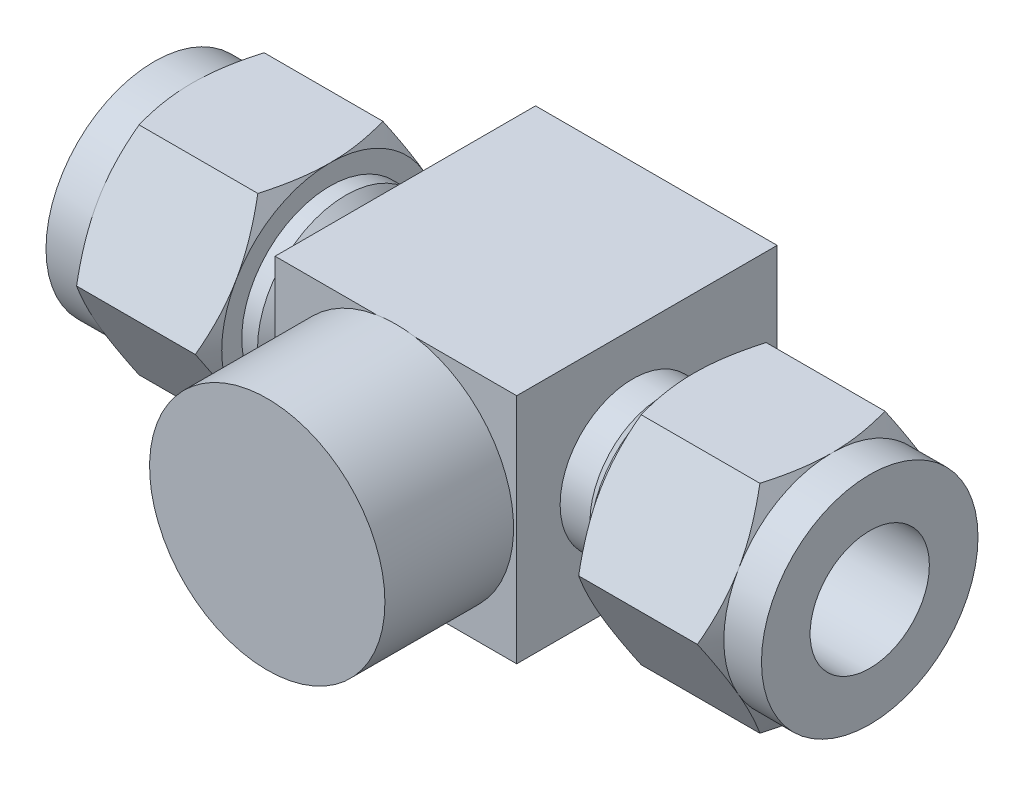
SolidWorks part; units mm, degrees
ref_plane "Front Plane" through (0, 0, 0) normal (0, 0, 1) x (1, 0, 0)
ref_plane "Top Plane" through (0, 0, 0) normal (0, 1, 0) x (1, 0, 0)
ref_plane "Right Plane" through (0, 0, 0) normal (1, 0, 0) x (0, 0, -1)
imported_body "Imported3"
sketch "Sketch1" plane through (-12.192, 0, 0) normal (-1, 0, 0) x (0, 0, 1)
  line L0 (17.5679, 0) -> (17.5679, 0.231)
  line L1 (17.5679, 0.231) -> (17.5634, 0.231)
  arc A0 (17.5634, 0.231) -> (17.5679, 0) centre (11.684, 0) cw
extrude "Cut-Extrude1" cut sketch "Sketch1" against normal blind 2.413
sketch "Sketch2" plane through (12.192, 0, 0) normal (1, 0, 0) x (0, 0, -1)
  line L0 (-17.5679, 0) -> (-17.5679, -5.8658)
  line L1 (-17.5679, -5.8658) -> (-12.1456, -5.8658)
  arc A0 (-12.1456, -5.8658) -> (-17.5679, 0) centre (-11.684, 0) cw
extrude "Cut-Extrude2" cut sketch "Sketch2" against normal blind 2.413
sketch "Sketch3" plane through (-12.192, 0, 0) normal (-1, 0, 0) x (0, 0, 1)
  line L0 (12.1456, -5.8658) -> (17.5679, -5.8658)
  line L1 (17.5679, -5.8658) -> (17.5679, 0)
  arc A0 (17.5679, 0) -> (12.1456, -5.8658) centre (11.684, 0) cw
extrude "Cut-Extrude3" cut sketch "Sketch3" against normal blind 2.413
sketch "Sketch4" plane through (12.192, 0, 0) normal (1, 0, 0) x (0, 0, -1)
  line L0 (-17.5634, 0.231) -> (-17.5679, 0.231)
  line L1 (-17.5679, 0.231) -> (-17.5679, 0)
  arc A0 (-17.5679, 0) -> (-17.5634, 0.231) centre (-11.684, 0) cw
extrude "Cut-Extrude4" cut sketch "Sketch4" against normal blind 2.413
ref_plane "Plane1" through (9.779, 0, 0) normal (1, 0, 0) x (0, 0, -1)
sketch "Sketch5" plane through (9.779, 0, 0) normal (1, 0, 0) x (0, 0, -1)
  line L0 (-17.5634, 0.231) -> (-5.8046, 0.231)
  arc A0 (-5.8046, 0.231) -> (-17.5634, 0.231) centre (-11.684, 0) ccw
extrude "Cut-Extrude5" cut sketch "Sketch5" against normal blind 19.558
sketch "Sketch6" plane through (0, 0.231, 0) normal (0, 1, 0) x (-1, 0, 0)
  line L0 (-9.779, 5.8046) -> (-9.779, 11.684)
  line L1 (-9.779, 11.684) -> (-9.779, 17.5679)
  line L2 (-9.779, 17.5679) -> (9.779, 17.5679)
  line L3 (9.779, 17.5679) -> (9.779, 11.684)
  line L4 (9.779, 11.684) -> (9.779, 5.8046)
  line L5 (9.779, 5.8046) -> (-9.779, 5.8046)
extrude "Boss-Extrude1" add sketch "Sketch6" along normal blind 5.6529
sketch "Sketch7" plane through (9.779, 0, 0) normal (1, 0, 0) x (0, 0, -1)
  line L0 (-11.2224, -5.8658) -> (-12.1456, -5.8658)
  arc A0 (-12.1456, -5.8658) -> (-11.2224, -5.8658) centre (-11.684, 0) ccw
extrude "Cut-Extrude6" cut sketch "Sketch7" against normal blind 19.558
sketch "Sketch8" plane through (9.779, 0, 0) normal (1, 0, 0) x (0, 0, -1)
  line L0 (-5.8046, 0.231) -> (-5.8046, -0.231)
  arc A0 (-5.8046, -0.231) -> (-5.8046, 0.231) centre (-11.684, 0) ccw
extrude "Cut-Extrude7" cut sketch "Sketch8" against normal blind 19.558
sketch "Sketch9" plane through (0, 0, 5.8046) normal (0, 0, -1) x (-1, 0, 0)
  line L0 (-9.779, -5.8658) -> (-9.779, 5.8839)
  line L1 (-9.779, 5.8839) -> (9.779, 5.8839)
  line L2 (9.779, 5.8839) -> (9.779, -5.8658)
  line L3 (9.779, -5.8658) -> (-9.779, -5.8658)
extrude "Boss-Extrude2" add sketch "Sketch9" along normal blind 5.8046
sketch "Sketch10" plane through (0, -5.8658, 0) normal (0, -1, 0) x (1, 0, 0)
  line L0 (-9.779, 17.5679) -> (9.779, 17.5679)
  line L1 (9.779, 17.5679) -> (9.779, 0)
  line L2 (9.779, 0) -> (-9.779, 0)
  line L3 (-9.779, 0) -> (-9.779, 17.5679)
extrude "Boss-Extrude3" add sketch "Sketch10" along normal blind 3.5322
sketch "Sketch11" plane through (0, 5.8839, 0) normal (0, 1, 0) x (-1, 0, 0)
  line L0 (-9.779, 17.5679) -> (9.779, 17.5679)
  line L1 (9.779, 17.5679) -> (9.779, 0)
  line L2 (9.779, 0) -> (-9.779, 0)
  line L3 (-9.779, 0) -> (-9.779, 17.5679)
extrude "Boss-Extrude4" add sketch "Sketch11" along normal blind 3.5141
sketch "Sketch12" plane through (0, 0, 17.5679) normal (0, 0, 1) x (1, 0, 0)
  line L0 (9.779, 9.398) -> (9.779, -9.398)
  line L1 (9.779, -9.398) -> (-9.779, -9.398)
  line L2 (-9.779, -9.398) -> (-9.779, 9.398)
  line L3 (-9.779, 9.398) -> (9.779, 9.398)
extrude "Boss-Extrude5" add sketch "Sketch12" along normal blind 3.5141
sketch "Sketch13" plane through (0, 0, 21.082) normal (0, 0, 1) x (1, 0, 0)
  circle A0 centre (0, 0) radius 9.525
extrude "Boss-Extrude6" add sketch "Sketch13" along normal blind 10.414
ref_plane "Plane2" through (0, 0, 31.496) normal (0, 0, -1) x (-1, 0, 0)
sketch "Sketch14" plane through (0, 0, 31.496) normal (0, 0, -1) x (-1, 0, 0)
  line L0 (0, -9.525) -> (28.956, -6.4816)
  line L1 (28.956, -6.4816) -> (28.956, 6.4816)
  line L2 (28.956, 6.4816) -> (0, 9.525)
  line L3 (0, 9.525) -> (-12.6644, 6.1316)
  line L4 (-12.6644, 6.1316) -> (-18.796, 0)
  line L5 (-18.796, 0) -> (-12.6644, -6.1316)
  line L6 (-12.6644, -6.1316) -> (0, -9.525)
extrude "Boss-Extrude7" [suppressed] add sketch "Sketch14" against normal blind 7.62
hole_wizard "CBORE for M6.5 SHSS1" positions "Sketch16" profile "Sketch15" counterbore size "M6.5" standard "ANSI Metric"
sketch "Sketch16" plane through (28.956, 0, 0) normal (1, 0, 0) x (0, 0, -1)
  point P0 (-11.684, 0)
sketch "Sketch15" plane through (28.956, 0, 11.684) normal (0, 1, 0) x (0, 0, -1)
  line L0 (0, 0) -> (0, 19.177)
  line L1 (0, 19.177) -> (3.556, 19.177)
  line L2 (3.556, 19.177) -> (3.556, 16.764)
  line L3 (3.556, 16.764) -> (4.826, 16.764)
  line L4 (4.826, 16.764) -> (4.826, 0)
  line L5 (4.826, 0) -> (0, 0)
  line L10 (0, 19.177) -> (-3.556, 19.177) construction
  line L11 (0, -6.35) -> (0, 107.95) construction
  dimension "Hole Dia." = 7.112
  dimension "Hole Depth" = 19.177
  dimension "C'Bore Dia." = 9.652
  dimension "C'Bore Depth" = 16.764
  dimension "Drill Angle" = 180
hole_wizard "CBORE for M6.5 SHSS2" positions "Sketch18" profile "Sketch17" counterbore size "M6.5" standard "ANSI Metric"
sketch "Sketch18" plane through (-28.956, 0, 0) normal (-1, 0, 0) x (0, 0, 1)
  point P0 (11.684, 0)
sketch "Sketch17" plane through (-28.956, 0, 11.684) normal (0, 1, 0) x (0, 0, 1)
  line L0 (0, 0) -> (0, 19.177)
  line L1 (0, 19.177) -> (3.556, 19.177)
  line L2 (3.556, 19.177) -> (3.556, 16.764)
  line L3 (3.556, 16.764) -> (4.826, 16.764)
  line L4 (4.826, 16.764) -> (4.826, 0)
  line L5 (4.826, 0) -> (0, 0)
  line L10 (0, 19.177) -> (-3.556, 19.177) construction
  line L11 (0, -6.35) -> (0, 107.95) construction
  dimension "Hole Dia." = 7.112
  dimension "Hole Depth" = 19.177
  dimension "C'Bore Dia." = 9.652
  dimension "C'Bore Depth" = 16.764
  dimension "Drill Angle" = 180
